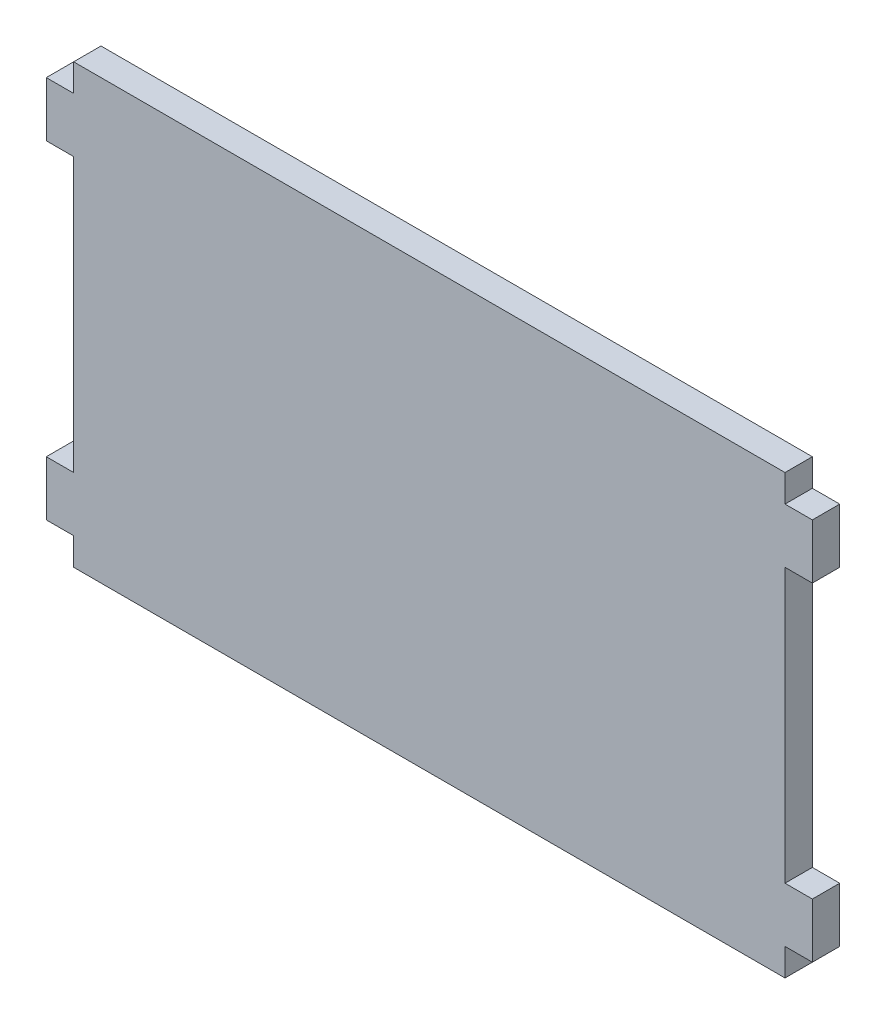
SolidWorks part; units mm, degrees
ref_plane "Front" through (0, 0, 0) normal (0, 0, 1) x (1, 0, 0)
ref_plane "Top" through (0, 0, 0) normal (0, 1, 0) x (1, 0, 0)
ref_plane "Right" through (0, 0, 0) normal (1, 0, 0) x (0, 0, -1)
sketch "Sketch1" plane through (0, 0, 0) normal (0, 0, 1) x (1, 0, 0)
  line L0 (41.275, 50.8) -> (41.275, 0) construction
  line L1 (0, 0) -> (82.55, 0)
  line L2 (0, 0) -> (0, 3.175)
  line L3 (0, 50.8) -> (82.55, 50.8)
  line L4 (82.55, 0) -> (82.55, 3.175)
  line L5 (82.55, 47.625) -> (85.725, 47.625)
  line L6 (82.55, 9.525) -> (82.55, 41.275)
  line L7 (82.55, 41.275) -> (85.725, 41.275)
  line L8 (85.725, 47.625) -> (85.725, 41.275)
  line L9 (0, 25.4) -> (82.55, 25.4) construction
  line L10 (82.55, 9.525) -> (85.725, 9.525)
  line L11 (85.725, 3.175) -> (85.725, 9.525)
  line L12 (82.55, 3.175) -> (85.725, 3.175)
  line L13 (0, 3.175) -> (-3.175, 3.175)
  line L14 (-3.175, 3.175) -> (-3.175, 9.525)
  line L15 (0, 9.525) -> (-3.175, 9.525)
  line L16 (0, 41.275) -> (-3.175, 41.275)
  line L17 (-3.175, 47.625) -> (-3.175, 41.275)
  line L18 (0, 47.625) -> (-3.175, 47.625)
  line L19 (82.55, 47.625) -> (82.55, 50.8)
  line L20 (0, 47.625) -> (0, 50.8)
  line L21 (0, 9.525) -> (0, 41.275)
  dimension "D1" = 50.8
  dimension "D2" = 82.55
  dimension "D3" = 6.35
  dimension "D4" = 3.175
  dimension "D5" = 3.175
  dimension "D6" = 3.175
extrude "Boss-Extrude1" add sketch "Sketch1" along normal blind 3.175
